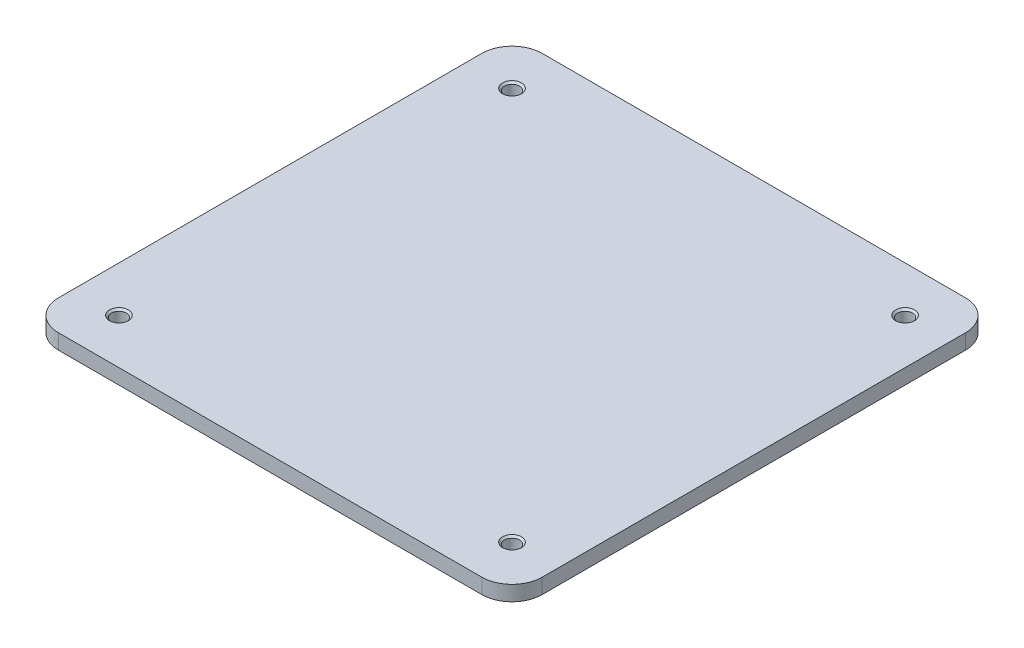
SolidWorks part; units mm, degrees
ref_plane "Front Plane" through (0, 0, 0) normal (0, 0, 1) x (1, 0, 0)
ref_plane "Top Plane" through (0, 0, 0) normal (0, 1, 0) x (1, 0, 0)
ref_plane "Right Plane" through (0, 0, 0) normal (1, 0, 0) x (0, 0, -1)
sketch "Sketch1" plane through (0, 0, 0) normal (0, 1, 0) x (1, 0, 0)
  line L1 (-101.6, 101.6) -> (101.6, 101.6)
  line L2 (-101.6, 101.6) -> (-101.6, -101.6)
  line L3 (-101.6, -101.6) -> (101.6, -101.6)
  line L4 (101.6, 101.6) -> (101.6, -101.6)
  line L5 (-101.6, 101.6) -> (101.6, -101.6) construction
  line L6 (-101.6, -101.6) -> (101.6, 101.6) construction
  point P0 (0, 0)
  dimension "D1" = 203.2
  dimension "D2" = 203.2
extrude "Boss-Extrude1" add sketch "Sketch1" along normal blind 6.35
sketch "Sketch2" plane through (0, 6.35, 0) normal (0, 1, 0) x (1, 0, 0)
  line L1 (-82.55, 82.55) -> (82.55, 82.55) construction
  line L2 (-82.55, 82.55) -> (-82.55, -82.55) construction
  line L3 (-82.55, -82.55) -> (82.55, -82.55) construction
  line L4 (82.55, 82.55) -> (82.55, -82.55) construction
  line L5 (-82.55, 82.55) -> (82.55, -82.55) construction
  line L6 (-82.55, -82.55) -> (82.55, 82.55) construction
  circle A0 centre (-82.55, 82.55) radius 3.175
  circle A1 centre (82.55, 82.55) radius 3.175
  circle A2 centre (82.55, -82.55) radius 3.175
  circle A3 centre (-82.55, -82.55) radius 3.175
  point P0 (0, 0)
  dimension "D1" = 6.35
  dimension "D2" = 165.1
  dimension "D3" = 165.1
extrude "Cut-Extrude1" cut sketch "Sketch2" against normal through all
chamfer "Chamfer1" distance 0.7937 angle 45 4 edges at (-82.55, 6.35, 85.725) (82.55, 6.35, 85.725) (82.55, 6.35, -79.375) (-82.55, 6.35, -79.375)
fillet "Fillet1" radius 12.7 4 edges at (101.6, 3.175, 101.6) (-101.6, 3.175, 101.6) (-101.6, 3.175, -101.6) (101.6, 3.175, -101.6)
equation "\"Buoyancy\"=\"SW-Volume\"*(\"SW-Density\"-.037062)"
